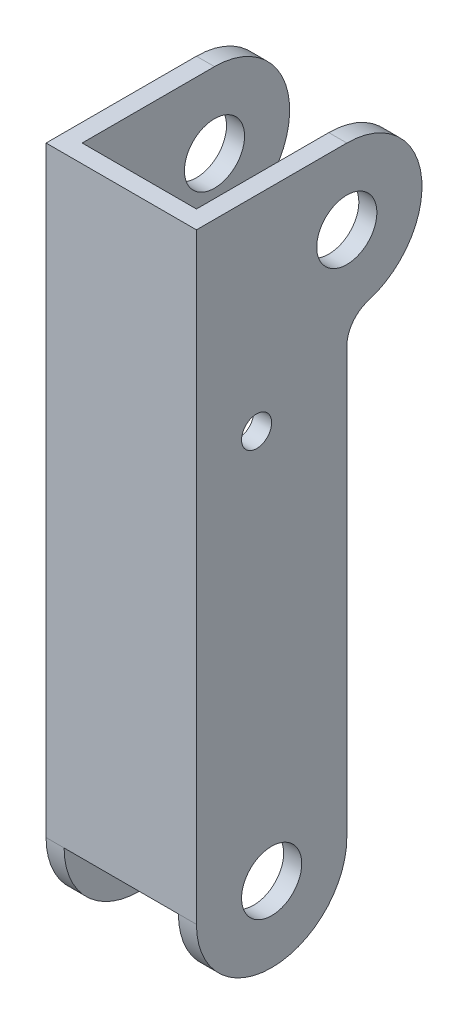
SolidWorks part; units mm, degrees
ref_plane "Front Plane" through (0, 0, 0) normal (0, 0, 1) x (1, 0, 0)
ref_plane "Top Plane" through (0, 0, 0) normal (0, 1, 0) x (1, 0, 0)
ref_plane "Right Plane" through (0, 0, 0) normal (1, 0, 0) x (0, 0, -1)
sketch "Sketch1" plane through (0, 0, 0) normal (1, 0, 0) x (0, 0, -1)
  line L0 (-41.9739, 0) -> (35.1158, 0) construction
  line L4 (25, 0) -> (25, 141.459)
  line L5 (25, 200) -> (-25, 200)
  line L6 (-25, 0) -> (-25, 200)
  circle A0 centre (0, 0) radius 10
  arc A1 (-25, 0) -> (25, 0) centre (0, 0) ccw
  circle A3 centre (25, 175) radius 10
  arc A4 (32.1429, 151.0421) -> (25, 141.459) centre (35, 141.459) ccw
  arc A6 (32.1429, 151.0421) -> (25, 200) centre (25, 175) ccw
  point P0 (0, 0)
  point P19 (-25, 200)
  dimension "D3" = 20
  dimension "D5" = 20
  dimension "D6" = 10
  dimension "D1" = 50
  dimension "D2" = 200
extrude "Boss-Extrude1" add sketch "Sketch1" along normal blind 6
ref_plane "Plane1" through (25, 0, 0) normal (-1, 0, 0) x (0, 0, 1)
sketch "Sketch6" plane through (0, 0, 25) normal (0, 0, 1) x (1, 0, 0)
  line L1 (0, 0) -> (50, 0)
  line L2 (0, 0) -> (0, 200)
  line L3 (0, 200) -> (50, 200)
  line L4 (50, 0) -> (50, 200)
  dimension "D1" = 200
  dimension "D2" = 50
extrude "Boss-Extrude5" add sketch "Sketch6" against normal blind 6
mirror "Mirror1" about plane through (25, 0, 0) normal (-1, 0, 0) of "Boss-Extrude1"
sketch "Sketch7" plane through (0, 0, 0) normal (-1, 0, 0) x (0, 0, 1)
  line L0 (-25, 200) -> (25, 200) construction
  line L1 (69.4262, 132) -> (-86.9302, 132) construction
  line L3 (25, 200) -> (25, 0) construction
  circle A0 centre (5, 132) radius 5
  point P0 (5.1323, 133.3358)
  dimension "D2" = 10
  dimension "D1" = 68
  dimension "D3" = 20
extrude "Cut-Extrude1" cut sketch "Sketch7" against normal blind 90
